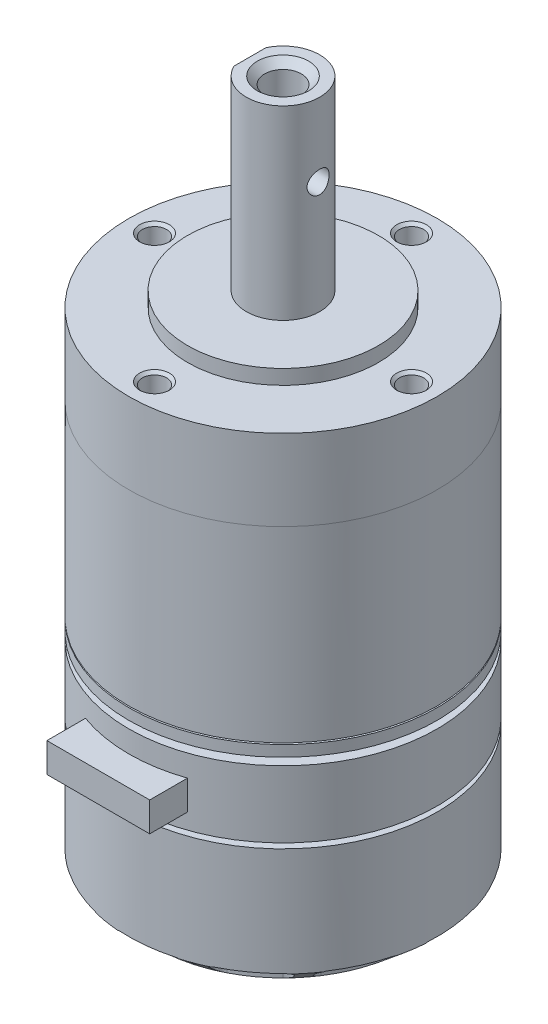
SolidWorks part; units mm, degrees
ref_plane "前视基准面" through (0, 0, 0) normal (0, 0, 1) x (1, 0, 0)
ref_plane "上视基准面" through (0, 0, 0) normal (0, 1, 0) x (1, 0, 0)
ref_plane "右视基准面" through (0, 0, 0) normal (1, 0, 0) x (0, 0, -1)
sketch "草图1" plane through (0, 0, 0) normal (0, 1, 0) x (1, 0, 0)
  circle A0 centre (0, 0) radius 21
extrude "凸台-拉伸1" add sketch "草图1" along normal blind 66.7
sketch "草图2" plane through (0, 66.7, 0) normal (0, 1, 0) x (1, 0, 0)
  circle A0 centre (0, 0) radius 13
extrude "凸台-拉伸2" add sketch "草图2" along normal blind 2
sketch "草图3" plane through (0, 68.7, 0) normal (0, 1, 0) x (1, 0, 0)
  circle A0 centre (0, 0) radius 5
extrude "凸台-拉伸3" add sketch "草图3" along normal blind 25.3
hole_wizard "M5 螺纹孔1" positions "草图4" profile "草图6" tap size "M5" standard "ISO"
sketch "草图4" plane through (0, 94, 0) normal (0, 1, 0) x (1, 0, 0)
  point P0 (0, 0)
sketch "草图6" plane through (0, 94, 0) normal (1, 0, 0) x (0, 0, 1)
  line L0 (0, 0) -> (0, 14.4434)
  line L1 (0, 14.4434) -> (2.5, 13)
  line L2 (2.5, 13) -> (2.5, 1)
  line L3 (2.5, 1) -> (3.5, 0)
  line L5 (3.5, 0) -> (0, 0)
  line L6 (-2.5, 1) -> (-3.5, 0) construction
  line L10 (0, 14.4434) -> (-2.5, 13) construction
  line L11 (0, -6.35) -> (0, 107.95) construction
  dimension "螺纹孔钻头直径" = 5
  dimension "螺纹孔钻头深度" = 13
  dimension "近端锥形沉头孔直径" = 7
  dimension "近端锥形沉头孔角度" = 90
  dimension "导头角度" = 120
sketch "草图7" plane through (0, 94, 0) normal (0, 1, 0) x (1, 0, 0)
  line L0 (0, 0) -> (-4.5, 0)
  line L1 (-4.5, 0) -> (-4.5, 2.1794)
  line L2 (-4.5, 2.1794) -> (-4.5, -2.1794)
  circle A0 centre (0, 0) radius 5 construction
  circle A3 centre (0, 0) radius 5
  arc A4 (-4.5, 2.1794) -> (-4.5, -2.1794) centre (0, 0) ccw
  dimension "D1" = 0
extrude "切除-拉伸1" cut sketch "草图7" against normal blind 20 contours L2 L1 M3
sketch "草图8" plane through (-4.5, 0, 0) normal (-1, 0, 0) x (0, 0, 1)
  line L0 (-2.1794, 94) -> (2.1794, 94) construction
  circle A0 centre (0, 84) radius 1.5
  dimension "D1" = 10
extrude "切除-拉伸2" cut sketch "草图8" against normal blind 20
sketch "草图9" plane through (0, 0, 0) normal (0, -1, 0) x (1, 0, 0)
  circle A0 centre (0, 0) radius 3.5
extrude "凸台-拉伸4" add sketch "草图9" along normal blind 5
sketch "草图10" plane through (0, 0, 0) normal (0, 0, 1) x (1, 0, 0)
  line L0 (21, 18.4) -> (7.8054, 18.4)
  line L1 (21, 0) -> (21, 66.7) construction
  line L2 (7.8054, 18.4) -> (7.8054, 17.7)
  line L3 (7.8054, 17.7) -> (21, 17.7)
  line L4 (21, 17.7) -> (21, 18.4)
  line L5 (21, 66.7) -> (-21, 66.7) construction
  line L6 (21, 30.2) -> (7.8054, 30.2)
  line L7 (7.8054, 30.2) -> (7.8054, 30)
  line L8 (7.8054, 30) -> (21, 30)
  line L9 (21, 30) -> (21, 30.2)
  line L10 (21, 28.5) -> (7.8054, 28.5)
  line L11 (7.8054, 28.5) -> (7.8054, 27.5)
  line L12 (7.8054, 27.5) -> (21, 27.5)
  line L13 (21, 27.5) -> (21, 28.5)
  dimension "D1" = 48.3
  dimension "D2" = 38.2
  dimension "D3" = 1
  dimension "D4" = 36.5
revolve "切除-旋转1" cut sketch "草图10" angle 360 about axis through (0, 94, 0) along (0, -1, 0)
chamfer "倒角1" distance 3.5 angle 40 1 edges at (0, 0, 21)
chamfer "倒角2" distance 0.5 angle 40 1 edges at (0, -5, -3.5)
sketch "草图11" plane through (0, 0, 0) normal (0, 0, 1) x (1, 0, 0)
  line L0 (17.1219, 1.3052) -> (19.8435, 3.5321)
  line L1 (19.8435, 3.5321) -> (19.8435, 5.1865)
  line L2 (19.8435, 5.1865) -> (0.4127, 5.1865)
  line L3 (0.4127, 5.1865) -> (0.4127, 1.3052)
  line L4 (0.4127, 1.3052) -> (17.1219, 1.3052)
revolve "切除-旋转2" cut sketch "草图11" angle 360 about axis through (0, 66.7, 0) along (0, -1, 0)
sketch "草图12" plane through (0, 0, 0) normal (0, -1, 0) x (1, 0, 0)
  line L0 (-1.8352, 17.4035) -> (-2.2022, 20.8842)
  line L1 (5.4503, 16.6296) -> (6.5404, 19.9555)
  line L2 (13.0349, 11.6765) -> (15.6419, 14.0118)
  line L3 (7.1125, 15.9895) -> (8.5349, 19.1874)
  line L4 (17.1268, 3.5947) -> (20.5522, 4.3136)
  line L5 (14.1543, 10.2911) -> (16.9852, 12.3493)
  line L6 (16.6296, -5.4503) -> (19.9555, -6.5404)
  line L7 (17.4035, 1.8352) -> (20.8842, 2.2022)
  line L8 (11.6765, -13.0349) -> (14.0118, -15.6419)
  line L9 (15.9895, -7.1125) -> (19.1874, -8.5349)
  line L10 (3.5947, -17.1268) -> (4.3136, -20.5522)
  line L11 (10.2911, -14.1543) -> (12.3493, -16.9852)
  line L12 (-5.4503, -16.6296) -> (-6.5404, -19.9555)
  line L13 (1.8352, -17.4035) -> (2.2022, -20.8842)
  line L14 (-13.0349, -11.6765) -> (-15.6419, -14.0118)
  line L15 (-7.1125, -15.9895) -> (-8.5349, -19.1874)
  line L16 (-17.1268, -3.5947) -> (-20.5522, -4.3136)
  line L17 (-14.1543, -10.2911) -> (-16.9852, -12.3493)
  line L18 (-16.6296, 5.4503) -> (-19.9555, 6.5404)
  line L19 (-17.4035, -1.8352) -> (-20.8842, -2.2022)
  line L20 (-11.6765, 13.0349) -> (-14.0118, 15.6419)
  line L21 (-15.9895, 7.1125) -> (-19.1874, 8.5349)
  line L22 (-3.5947, 17.1268) -> (-4.3136, 20.5522)
  line L23 (-10.2911, 14.1543) -> (-12.3493, 16.9852)
  arc A0 (15.6419, 14.0118) -> (8.5349, 19.1874) centre (0, 0) ccw
  arc A1 (-1.8352, 17.4035) -> (5.4503, 16.6296) centre (0, 0) cw
  arc A2 (7.1125, 15.9895) -> (13.0349, 11.6765) centre (0, 0) cw
  circle A3 centre (0, 0) radius 17.5 construction
  circle A4 centre (0, 0) radius 21 construction
  arc A5 (20.5522, 4.3136) -> (16.9852, 12.3493) centre (0, 0) ccw
  arc A6 (14.1543, 10.2911) -> (17.1268, 3.5947) centre (0, 0) cw
  circle A7 centre (0, 0) radius 21
  arc A8 (6.5404, 19.9555) -> (-2.2022, 20.8842) centre (0, 0) ccw
  arc A9 (19.9555, -6.5404) -> (20.8842, 2.2022) centre (0, 0) ccw
  arc A10 (17.4035, 1.8352) -> (16.6296, -5.4503) centre (0, 0) cw
  arc A11 (14.0118, -15.6419) -> (19.1874, -8.5349) centre (0, 0) ccw
  arc A12 (15.9895, -7.1125) -> (11.6765, -13.0349) centre (0, 0) cw
  arc A13 (4.3136, -20.5522) -> (12.3493, -16.9852) centre (0, 0) ccw
  arc A14 (10.2911, -14.1543) -> (3.5947, -17.1268) centre (0, 0) cw
  arc A15 (-6.5404, -19.9555) -> (2.2022, -20.8842) centre (0, 0) ccw
  arc A16 (1.8352, -17.4035) -> (-5.4503, -16.6296) centre (0, 0) cw
  arc A17 (-15.6419, -14.0118) -> (-8.5349, -19.1874) centre (0, 0) ccw
  arc A18 (-7.1125, -15.9895) -> (-13.0349, -11.6765) centre (0, 0) cw
  arc A19 (-20.5522, -4.3136) -> (-16.9852, -12.3493) centre (0, 0) ccw
  arc A20 (-14.1543, -10.2911) -> (-17.1268, -3.5947) centre (0, 0) cw
  arc A21 (-19.9555, 6.5404) -> (-20.8842, -2.2022) centre (0, 0) ccw
  arc A22 (-17.4035, -1.8352) -> (-16.6296, 5.4503) centre (0, 0) cw
  arc A23 (-14.0118, 15.6419) -> (-19.1874, 8.5349) centre (0, 0) ccw
  arc A24 (-15.9895, 7.1125) -> (-11.6765, 13.0349) centre (0, 0) cw
  arc A25 (-4.3136, 20.5522) -> (-12.3493, 16.9852) centre (0, 0) ccw
  arc A26 (-10.2911, 14.1543) -> (-3.5947, 17.1268) centre (0, 0) cw
  point P58 (0, 0)
  dimension "D1" = 0
  dimension "D2" = 12
extrude "切除-拉伸3" cut sketch "草图12" against normal blind 3
fillet "圆角1" radius 1 48 edges at (-1.8352, 0.8073, 17.4035) (-2.1075, 3, 19.9858) (6.259, 3, 19.0971) (5.4503, 0.8073, 16.6296) (-15.9895, 0.8073, 7.1125) (-18.3619, 3, 8.1678) (-13.409, 3, 14.969) (-11.6765, 0.8073, 13.0349) (-10.2911, 0.8073, 14.1543) (-11.818, 3, 16.2545) (-4.1281, 3, 19.6681) (-3.5947, 0.8073, 17.1268) (-17.4035, 0.8073, -1.8352) (-19.9858, 3, -2.1075) (-19.0971, 3, 6.259) (-16.6296, 0.8073, 5.4503) (-8.1678, 3, -18.3619) (-14.969, 3, -13.409) (-13.0349, 0.8073, -11.6765) (-14.1543, 0.8073, -10.2911) (-16.2545, 3, -11.818) (-19.6681, 3, -4.1281) (-17.1268, 0.8073, -3.5947) (1.8352, 0.8073, -17.4035) (2.1075, 3, -19.9858) (-6.259, 3, -19.0971) (-5.4503, 0.8073, -16.6296) (15.9895, 0.8073, -7.1125) (18.3619, 3, -8.1678) (13.409, 3, -14.969) (11.6765, 0.8073, -13.0349) (10.2911, 0.8073, -14.1543) (11.818, 3, -16.2545) (4.1281, 3, -19.6681) (3.5947, 0.8073, -17.1268) (17.4035, 0.8073, 1.8352) (19.9858, 3, 2.1075) (19.0971, 3, -6.259) (16.6296, 0.8073, -5.4503) (7.1125, 0.8073, 15.9895) (8.1678, 3, 18.3619) (14.969, 3, 13.409) (13.0349, 0.8073, 11.6765) (14.1543, 0.8073, 10.2911) (16.2545, 3, 11.818) (19.6681, 3, 4.1281) (17.1268, 0.8073, 3.5947) (-7.1125, 0.8073, -15.9895)
sketch "草图13" plane through (0, 0, 0) normal (1, 0, 0) x (0, 0, -1)
  line L0 (-30.6434, 55.7) -> (45.9652, 55.7)
  line L1 (21, 66.7) -> (-21, 66.7) construction
  dimension "D1" = 11
split "分割1" trim tools "草图13" bodies to split 115 resulting bodies 116 117
sketch "草图14" plane through (0, 66.7, 0) normal (0, 1, 0) x (1, 0, 0)
  circle A0 centre (0, 0) radius 17.5 construction
  point P3 (0, 17.5)
  point P4 (17.5, 0)
  point P5 (0, -17.5)
  point P6 (-17.5, 0)
hole_wizard "M4 螺纹孔1" positions "3D草图1" profile "草图15" tap size "M4" standard "ISO"
sketch3d "3D草图1"
  point P0 (0, 66.7, -17.5)
  point P3 (-17.5, 66.7, 0)
  point P6 (0, 66.7, 17.5)
  point P9 (17.5, 66.7, 0)
sketch "草图15" plane through (0, 66.7, -17.5) normal (1, 0, 0) x (0, 0, 1)
  line L0 (0, 0) -> (0, 10.9526)
  line L1 (0, 10.9526) -> (1.65, 10)
  line L2 (1.65, 10) -> (1.65, 0.375)
  line L3 (1.65, 0.375) -> (2.025, 0)
  line L5 (2.025, 0) -> (0, 0)
  line L6 (-1.65, 0.375) -> (-2.025, 0) construction
  line L10 (0, 10.9526) -> (-1.65, 10) construction
  line L11 (0, -6.35) -> (0, 107.95) construction
  dimension "螺纹孔钻头直径" = 3.3
  dimension "螺纹孔钻头深度" = 10
  dimension "近端锥形沉头孔直径" = 4.05
  dimension "近端锥形沉头孔角度" = 90
  dimension "导头角度" = 120
ref_plane "基准面1" through (0, 0, 25) normal (0, 0, 1) x (1, 0, 0)
sketch "草图16" plane through (0, 0, 25) normal (0, 0, 1) x (1, 0, 0)
  line L1 (-7.155, 24.5456) -> (6.845, 24.5456)
  line L2 (-7.155, 24.5456) -> (-7.155, 20.5456)
  line L3 (-7.155, 20.5456) -> (6.845, 20.5456)
  line L4 (6.845, 24.5456) -> (6.845, 20.5456)
extrude "凸台-拉伸5" add sketch "草图16" against normal up to body
sketch "草图17" plane through (0, 0, 25) normal (0, 0, 1) x (1, 0, 0)
  line L0 (-23.2139, 68.7) -> (30.2098, 68.7)
split "分割2" trim tools "草图17" bodies to split 118 resulting bodies 120 121
